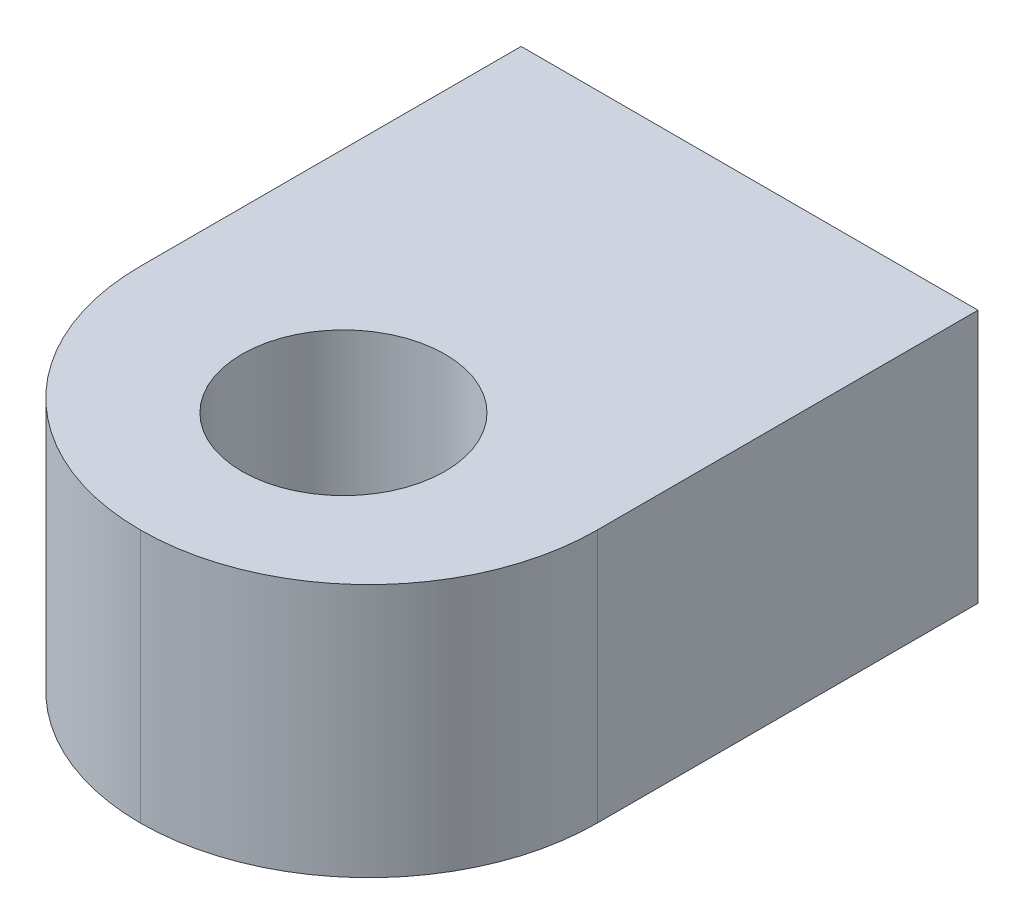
SolidWorks part; units mm, degrees
ref_plane "前基準面" through (0, 0, 0) normal (0, 0, 1) x (1, 0, 0)
ref_plane "上基準面" through (0, 0, 0) normal (0, 1, 0) x (1, 0, 0)
ref_plane "右基準面" through (0, 0, 0) normal (1, 0, 0) x (0, 0, -1)
sketch "草圖1" plane through (0, 0, 0) normal (0, 0, 1) x (1, 0, 0)
  line L1 (0, 0) -> (45, 0)
  line L2 (0, 0) -> (0, 25)
  line L3 (0, 25) -> (45, 25)
  line L4 (45, 0) -> (45, 25)
  dimension "D1" = 45
  dimension "D2" = 25
extrude "填料-伸長1" add sketch "草圖1" along normal blind 60
sketch "草圖2" plane through (0, 25, 0) normal (0, 1, 0) x (-1, 0, 0)
  line L0 (-22.5, 40) -> (-22.5, 0) construction
  line L1 (-45, 0) -> (0, 0) construction
  line L2 (-45, 60) -> (0, 60) construction
  circle A0 centre (-22.5, 40) radius 10
  dimension "D1" = 20
  dimension "D2" = 20
extrude "除料-伸長1" cut sketch "草圖2" against normal through all
fillet "圓角1" radius 22.5 2 edges at (0, 12.5, 60) (45, 12.5, 60)
hole_wizard "M6 螺紋孔1" positions "草圖4" profile "草圖3" tap size "M6" standard "IS"
sketch "草圖4" plane through (0, 0, 0) normal (0, 0, -1) x (-1, 0, 0)
  line L0 (-45, 0) -> (-45, 25) construction
  line L1 (-45, 25) -> (0, 25) construction
  point P0 (-37.5, 12.5)
  point P1 (-7.5, 12.5)
  dimension "D1" = 30
  dimension "D2" = 7.5
  dimension "D3" = 12.5
sketch "草圖3" plane through (37.5, 12.5, 0) normal (1, 0, 0) x (0, 1, 0)
  line L0 (0, 0) -> (0, 16.5022)
  line L1 (0, 16.5022) -> (2.5, 15)
  line L2 (2.5, 15) -> (2.5, 0)
  line L5 (2.5, 0) -> (0, 0)
  line L10 (0, 16.5022) -> (-2.5, 15) construction
  line L11 (0, -6.35) -> (0, 107.95) construction
  dimension "螺孔鑽直徑" = 5
  dimension "螺孔鑽深度" = 15
  dimension "導頭角度" = 118
